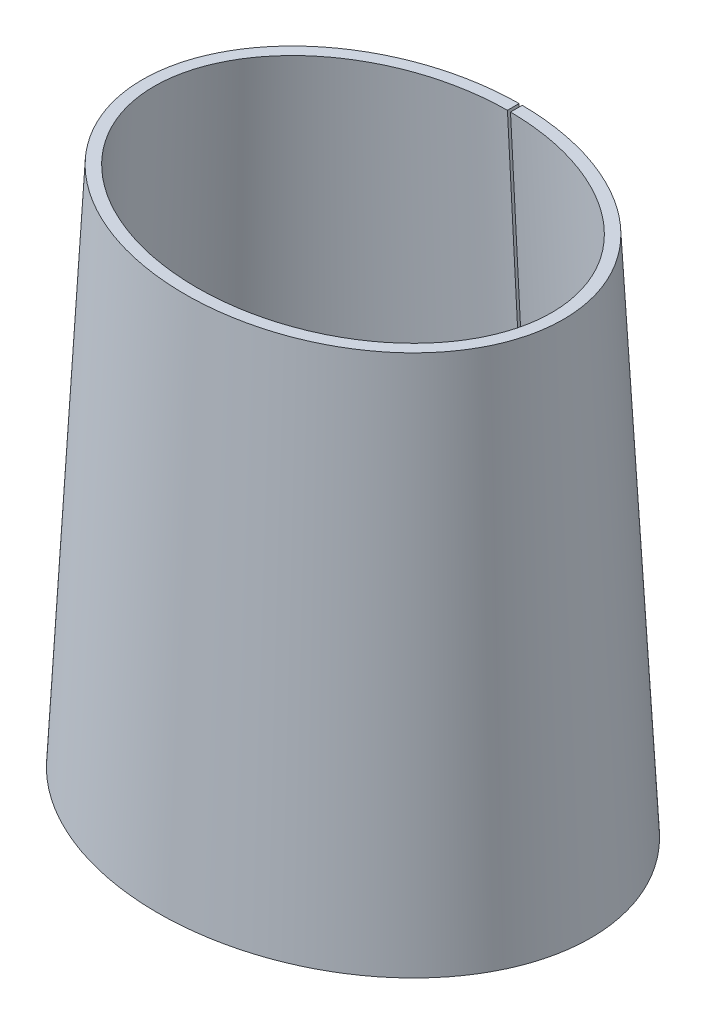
SolidWorks part; units mm, degrees
ref_plane "Alzado" through (0, 0, 0) normal (0, 0, 1) x (1, 0, 0)
ref_plane "Planta" through (0, 0, 0) normal (0, 1, 0) x (1, 0, 0)
ref_plane "Vista lateral" through (0, 0, 0) normal (1, 0, 0) x (0, 0, -1)
sketch "Croquis1" plane through (0, 0, 0) normal (0, 1, 0) x (1, 0, 0)
  ellipse E0 centre (0, 0) end of major axis (-38.494, -0.6803) minor radius 31.5
extrude "Saliente-Extruir1" add sketch "Croquis1" along normal blind 85 draft 3
shell "Vaciado1" thickness 1.9
sketch "Croquis2" plane through (0, 0, 0) normal (0, 0, 1) x (1, 0, 0)
  line L0 (0, -5.3916) -> (0, 91.7297)
  line L1 (0.5, -5.3916) -> (0.5, 91.7297)
  line L2 (0, 91.7297) -> (0.5, 91.7297)
  line L3 (0, -5.3916) -> (0.5, -5.3916)
  dimension "D1" = 0.5
extrude "Cortar-Extruir1" cut sketch "Croquis2" against normal blind 85
